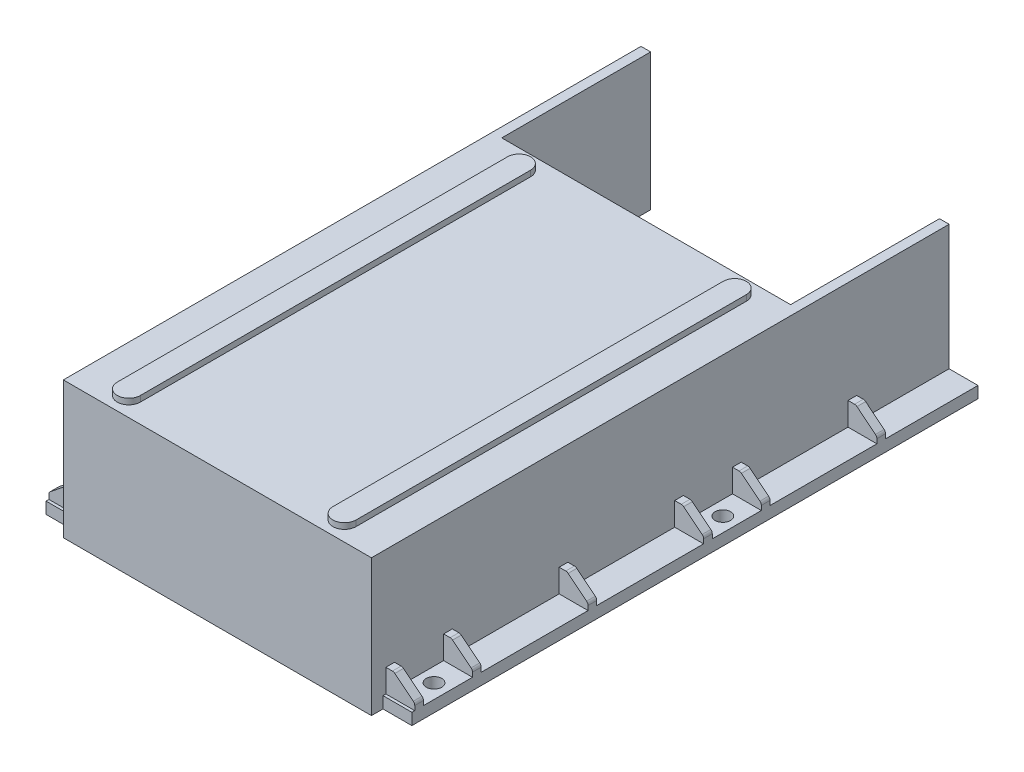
SolidWorks part; units mm, degrees
ref_plane "Plan de face" through (0, 0, 0) normal (0, 0, 1) x (1, 0, 0)
ref_plane "Plan de dessus" through (0, 0, 0) normal (0, 1, 0) x (1, 0, 0)
ref_plane "Plan de droite" through (0, 0, 0) normal (1, 0, 0) x (0, 0, -1)
sketch "Esquisse1" plane through (0, 0, 0) normal (0, 0, 1) x (1, 0, 0)
  line L0 (0, 0) -> (95, 0)
  line L1 (95, 0) -> (95, 6)
  line L2 (95, 6) -> (80, 6)
  line L3 (80, 6) -> (80, 71)
  line L4 (80, 71) -> (0, 71)
  line L5 (0, 0) -> (0, 71)
  dimension "D1" = 6
  dimension "D2" = 80
  dimension "D3" = 15
  dimension "D4" = 65
extrude "Extrusion1" add sketch "Esquisse1" along normal blind 300
sketch "Esquisse2" plane through (0, 6, 0) normal (0, 1, 0) x (1, 0, 0)
  line L0 (80, -300) -> (80, 0) construction
  line L1 (95, -300) -> (80, -300)
  line L2 (95, -300) -> (95, -294)
  line L3 (95, -294) -> (80, -294)
  line L4 (80, -300) -> (80, -294)
  dimension "D1" = 6
extrude "Enlèv. mat.-Extru.1" cut sketch "Esquisse2" against normal blind 294
sketch "Esquisse3" plane through (0, 71, 0) normal (0, 1, 0) x (1, 0, 0)
  line L1 (0, 0) -> (75, 0)
  line L2 (0, 0) -> (0, -77.3296)
  line L3 (0, -77.3296) -> (75, -77.3296)
  line L4 (75, 0) -> (75, -77.3296)
  dimension "D1" = 75
extrude "Enlèv. mat.-Extru.2" cut sketch "Esquisse3" against normal through all
sketch "Esquisse4" plane through (0, 0, 0) normal (0, -1, 0) x (1, 0, 0)
  line L0 (0, 300) -> (0, 77.3296) construction
  line L1 (0, 297) -> (77, 297)
  line L2 (0, 297) -> (0, 80.3296)
  line L3 (0, 80.3296) -> (77, 80.3296)
  line L4 (77, 297) -> (77, 80.3296)
  line L5 (0, 300) -> (80, 300) construction
  line L6 (80, 294) -> (80, 300) construction
  line L7 (0, 77.3296) -> (75, 77.3296) construction
  dimension "D1" = 3
  dimension "D2" = 3
  dimension "D3" = 3
extrude "Enlèv. mat.-Extru.3" cut sketch "Esquisse4" against normal blind 68
sketch "Esquisse5" plane through (0, 0, 0) normal (0, -1, 0) x (1, 0, 0)
  line L0 (62, 77.3296) -> (75, 62.3296)
  line L1 (0, 77.3296) -> (75, 77.3296) construction
  line L2 (75, 77.3296) -> (75, 0) construction
  line L3 (57, 77.3296) -> (75, 57.3296)
  line L4 (57, 77.3296) -> (62, 77.3296)
  line L5 (75, 62.3296) -> (75, 57.3296)
  dimension "D1" = 13
  dimension "D2" = 15
  dimension "D3" = 5
  dimension "D4" = 5
extrude "Extrusion2" add sketch "Esquisse5" against normal blind 28
ref_plane "Plan1" through (0, 0, 48) normal (0, 0, -1) x (-1, 0, 0)
sketch "Esquisse6" plane through (0, 0, 48) normal (0, 0, -1) x (-1, 0, 0)
  line L0 (-95, 6) -> (-95, 8.3)
  line L1 (-94.2523, 9.8594) -> (-84.664, 17.5594)
  line L2 (-83.4117, 18) -> (-80, 18)
  line L3 (-80, 6) -> (-80, 71) construction
  line L4 (-95, 6) -> (-80, 6) construction
  arc A0 (-94.2523, 9.8594) -> (-95, 8.3) centre (-93, 8.3) ccw
  arc A1 (-83.4117, 18) -> (-84.664, 17.5594) centre (-83.4117, 16) ccw
  dimension "D2" = 2
  dimension "D3" = 2
  dimension "D1" = 12
rib "Nervure4" sketch "Esquisse6" sketch "Esquisse6" thickness 4.5 extrusion direction parallel to sketch draft on no parameters "D1"=4.5
pattern_linear "Répétition linéaire1" count 2 spacing 60 along (0, 0, 1) of "Nervure4"
pattern_linear "Répétition linéaire2" count 2 spacing 90 along (0, 0, 1) of "Nervure4"
pattern_linear "Répétition linéaire3" count 2 spacing 150 along (0, 0, 1) of "Nervure4"
pattern_linear "Répétition linéaire4" count 2 spacing 210 along (0, 0, 1) of "Nervure4"
pattern_linear "Répétition linéaire5" count 2 spacing 240 along (0, 0, 1) of "Nervure4"
sketch "Esquisse7" plane through (0, 71, 0) normal (0, 1, 0) x (1, 0, 0)
  line L0 (50, -87.3296) -> (50, -290)
  line L1 (62, -87.3296) -> (62, -290)
  line L2 (75, -77.3296) -> (75, 0) construction
  line L3 (0, -77.3296) -> (75, -77.3296) construction
  line L4 (80, -300) -> (0, -300) construction
  arc A0 (50, -87.3296) -> (62, -87.3296) centre (56, -87.3296) cw
  arc A1 (50, -290) -> (62, -290) centre (56, -290) ccw
  dimension "D1" = 6
  dimension "D3" = 10
  dimension "D2" = 13
  dimension "D4" = 10
extrude "Extrusion3" add sketch "Esquisse7" along normal blind 3
hole_wizard "Diamètre du perçage Ø8.0 (8)2" positions "Esquisse11" profile "Esquisse10" hole size "Ø8.0" standard "ISO"
sketch "Esquisse11" plane through (0, 6, 0) normal (0, 1, 0) x (-1, 0, 0)
  line L0 (-95, 288) -> (-95, 262.5) construction
  line L1 (-95, 138) -> (-95, 112.5) construction
  line L4 (-95, 294) -> (-80, 294) construction
  line L5 (-95, 0) -> (-80, 0) construction
  point P0 (-87.5, 275)
  point P1 (-87.5, 125)
  dimension "D1" = 7.5
  dimension "D2" = 7.5
  dimension "D3" = 125
  dimension "D4" = 19
sketch "Esquisse10" plane through (87.5, 6, 275) normal (1, 0, 0) x (0, 0, 1)
  line L0 (0, 0) -> (0, 12.4034)
  line L1 (0, 12.4034) -> (4, 10)
  line L2 (4, 10) -> (4, 0)
  line L5 (4, 0) -> (0, 0)
  line L10 (0, 12.4034) -> (-4, 10) construction
  line L11 (0, -6.35) -> (0, 107.95) construction
  dimension "Diamètre du perçage" = 8
  dimension "Profondeur du perçage" = 10
  dimension "Angle de pointe" = 118
mirror "Symétrie1" about plane through (0, 0, 0) normal (1, 0, 0) of "Extrusion1", "Enlèv. mat.-Extru.1", "Enlèv. mat.-Extru.2", "Enlèv. mat.-Extru.3", "Extrusion2", "Nervure4", "Répétition linéaire1", "Répétition linéaire2", "Répétition linéaire3", "Répétition linéaire4", "Répétition linéaire5", "Extrusion3", "Diamètre du perçage Ø8.0 (8)2"
